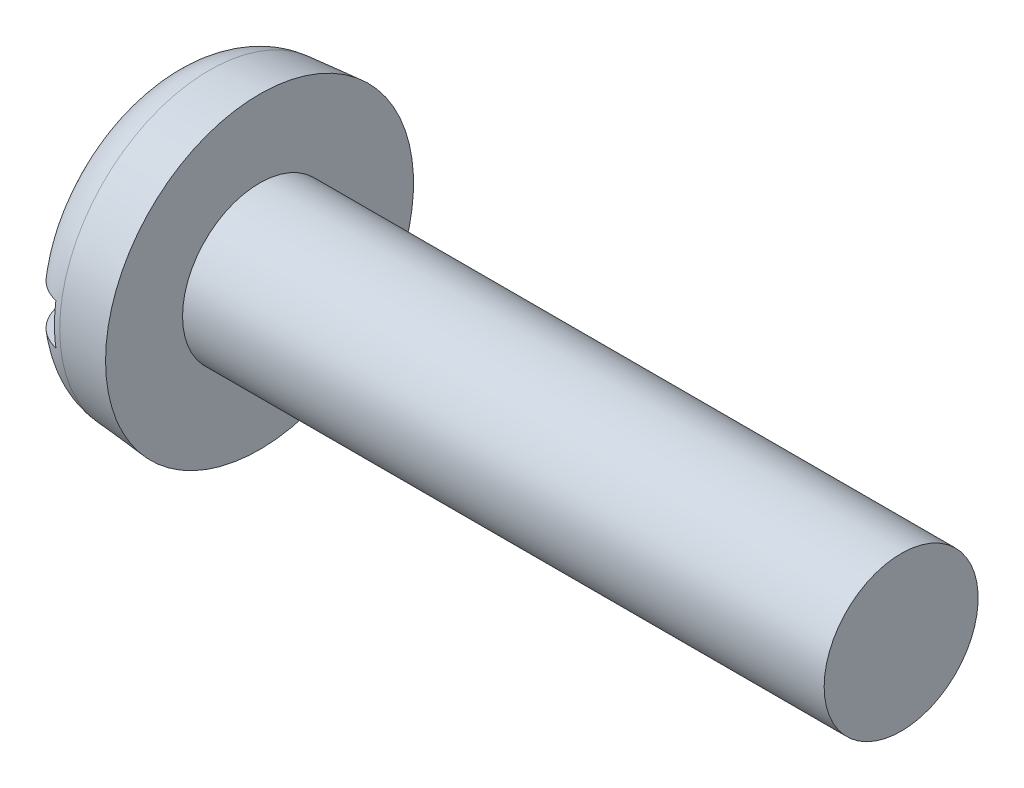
SolidWorks part; units mm, degrees
ref_plane "Plane1" through (0, 0, 0) normal (0, 0, 1) x (1, 0, 0)
ref_plane "Plane2" through (0, 0, 0) normal (0, 1, 0) x (1, 0, 0)
ref_plane "Plane3" through (0, 0, 0) normal (1, 0, 0) x (0, 0, -1)
sketch "BodySke" plane through (0, 0, 0) normal (0, 0, 1) x (1, 0, 0)
  line L0 (3.6, 3) -> (3.6, 6)
  line L1 (0, 0) -> (0, 5.685)
  line L2 (-25.4, 0) -> (127, 0) construction
  line L3 (28.6, 0) -> (0, 0)
  line L4 (3.6, 3) -> (28.6, 3)
  line L5 (28.6, 3) -> (28.6, 0)
  line L6 (0, 5.685) -> (3.6, 6)
  line L9 (4.6, 4.5875) -> (4.6, -4.9375) construction
  line L10 (3.6, 6.35) -> (3.6, -3.175) construction
  dimension "Head_ht" = 3.6
  dimension "Diameter" = 6
  dimension "Length" = 25
  dimension "Head_dia" = 12
  dimension "Advance" = 1
  dimension "Thread_nom" = 25
  dimension "Head_side_angle" = 5
revolve "Base-Revolve" add sketch "BodySke"
fillet "Fillet1" [suppressed] radius 0.25
fillet "Fillet2" radius 1.8 1 edges at (0, 0, 5.685)
sketch "Sketch2" plane through (0, 0, 0) normal (1, 0, 0) x (0, 0, -1)
  line L0 (6, -0.8) -> (-6, -0.8)
  line L1 (6, -0.8) -> (6, 0.8)
  line L2 (-6, 0.8) -> (6, 0.8)
  line L3 (-6, 0.8) -> (-6, -0.8)
  dimension "D1" = 12
  dimension "D2" = 6
  dimension "Slot_width" = 1.6
  dimension "D3" = 0.8
extrude "Slot" cut sketch "Sketch2" along normal blind 1.4
sketch "ThdSchSke" plane through (0, 0, 0) normal (0, 0, 1) x (1, 0, 0)
  line L0 (5.6, -2.4455) -> (5.2117, -3)
  line L1 (5.6, -2.4455) -> (5.9883, -3)
  line L2 (5.9883, -3) -> (5.9883, -3.75)
  line L3 (-3.175, 0) -> (5.1513, 0) construction
  line L5 (5.9883, -3.75) -> (5.2117, -3.75)
  line L6 (5.2117, -3.75) -> (5.2117, -3)
  dimension "Thread_minor" = 4.891
  dimension "Diameter" = 6
  dimension "Start" = 5.6
  dimension "SideAngle" = 55
  dimension "VeeAngle" = 70
  dimension "Overcut" = 7.5
revolve "ThreadSchematic" [suppressed] cut sketch "ThdSchSke" angle 360 about L3
pattern_linear "ThdSchPat" [suppressed]
equation "\"D1@Sketch2\" = \"Head_dia@BodySke\""
equation "\"D2@Sketch2\" = \"D1@Sketch2\" / 2"
equation "\"D3@Sketch2\" = \"Slot_width@Sketch2\" / 2"
equation "\"Thread_length@ThreadCosmetic\" = ((sgn( (\"Length@BodySke\" - \"Advance@BodySke\" * 2.0 ) - \"Thread_nom@BodySke\" )-1)*( (\"Length@BodySke\" - \"Advance@BodySke\"  * 2.0) - \"Thread_nom@BodySke\" ))/-2+ \"Thread_"
equation "\"Thread_minor@ThdSchSke\" = \"Thread_minor@ThreadCosmetic\""
equation "\"Diameter@ThdSchSke\" = \"Diameter@BodySke\""
equation "\"Overcut@ThdSchSke\" = \"Diameter@BodySke\" * 1.25"
equation "\"Start@ThdSchSke\" = \"Head_ht@BodySke\" + \"Length@BodySke\" - \"Thread_length@ThreadCosmetic\"  '---Non-countersunk---"
equation "\"Num_threads@ThdSchPat\" = int( \"Thread_length@ThreadCosmetic\" / \"Advance@BodySke\" + 0.999 )  + 1"
equation "\"Advance@ThdSchPat\" = \"Thread_length@ThreadCosmetic\" /  (\"Num_threads@ThdSchPat\" - 1) 'relax it"
